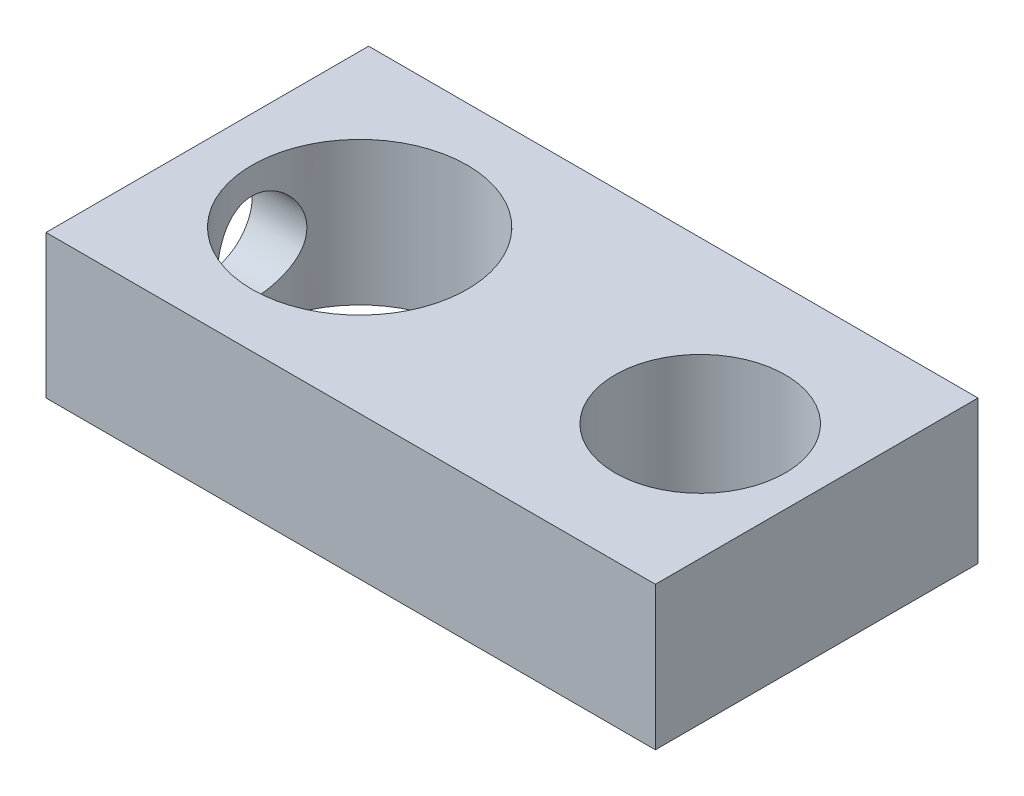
SolidWorks part; units mm, degrees
ref_plane "FRONT" through (0, 0, 0) normal (0, 0, 1) x (1, 0, 0)
ref_plane "TOP" through (0, 0, 0) normal (0, 1, 0) x (1, 0, 0)
ref_plane "RIGHT" through (0, 0, 0) normal (1, 0, 0) x (0, 0, -1)
sketch "Sketch1" plane through (0, 0, 0) normal (0, 1, 0) x (1, 0, 0)
  line L0 (-13.4938, 0) -> (94.4563, 0) construction
  line L1 (-13.4938, -14.2875) -> (40.4813, -14.2875)
  line L2 (-13.4938, -14.2875) -> (-13.4938, 14.2875)
  line L3 (-13.4938, 14.2875) -> (40.4813, 14.2875)
  line L4 (30.1625, 9.525) -> (30.1625, -9.525) construction
  line L5 (-50, 0) -> (50, 0) construction
  line L6 (0, -50) -> (0, 50) construction
  line L7 (40.4813, 14.2875) -> (40.4813, -14.2875)
  circle A0 centre (0, 0) radius 9.5326
  circle A1 centre (30.1625, 0) radius 7.5362
  dimension "D1" = 19.0652
  dimension "D4" = 15.0724
  dimension "D5" = 30.1625
  dimension "D8" = 4.7549
  dimension "D6" = 53.975
  dimension "D2" = 13.4938
  dimension "D3" = 28.575
  dimension "D7" = 3.9611
extrude "Base-Extrude" add sketch "Sketch1" along normal blind 12.7
sketch "Sketch2" plane through (-13.4938, 0, 0) normal (-1, 0, 0) x (0, 0, 1)
  line L0 (0, 12.7) -> (0, 0) construction
  line L1 (50, 0) -> (-50, 0) construction
  circle A0 centre (0, 6.35) radius 3.9878
  dimension "D1" = 7.9756
  dimension "D2" = 6.35
extrude "Cut-Extrude1" cut sketch "Sketch2" against normal blind 12.7
